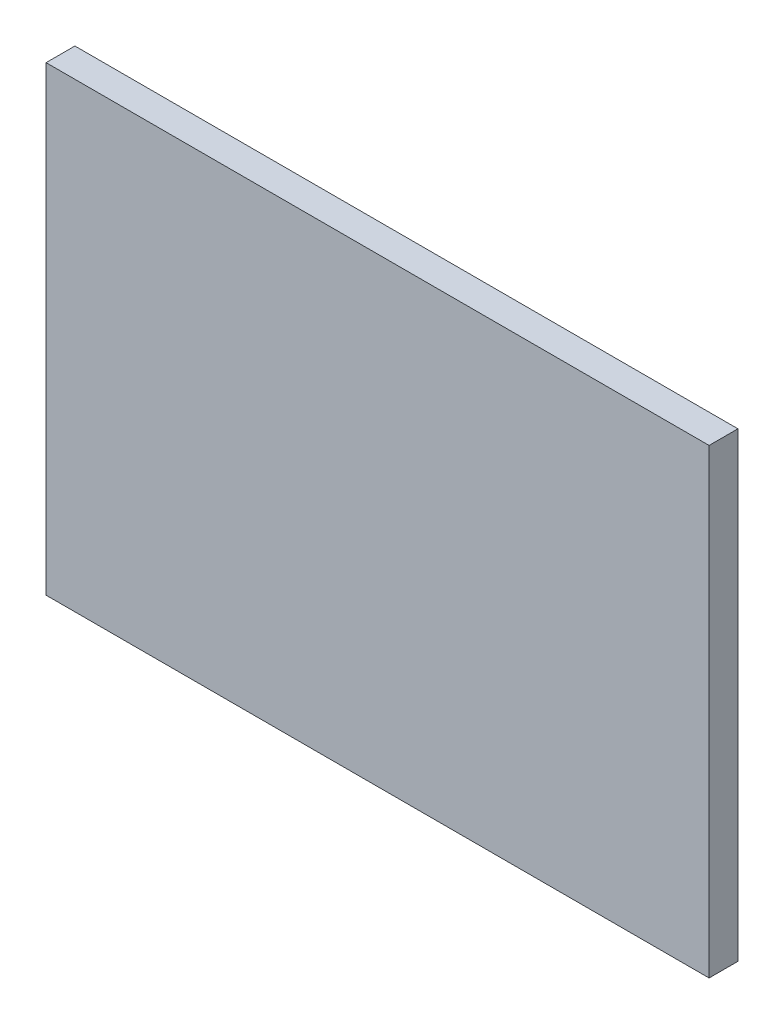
SolidWorks part; units mm, degrees
ref_plane "FRONT" through (0, 0, 0) normal (0, 0, 1) x (1, 0, 0)
ref_plane "TOP" through (0, 0, 0) normal (0, 1, 0) x (1, 0, 0)
ref_plane "RIGHT" through (0, 0, 0) normal (1, 0, 0) x (0, 0, -1)
sketch "Sketch1" plane through (0, 0, 0) normal (0, 0, 1) x (1, 0, 0)
  line L1 (-73.025, -50.8) -> (73.025, -50.8)
  line L2 (-73.025, -50.8) -> (-73.025, 50.8)
  line L3 (-73.025, 50.8) -> (73.025, 50.8)
  line L4 (73.025, -50.8) -> (73.025, 50.8)
  line L5 (-73.025, -50.8) -> (73.025, 50.8) construction
  line L6 (-73.025, 50.8) -> (73.025, -50.8) construction
  point P0 (0, 0)
  dimension "D1" = 146.05
  dimension "D2" = 101.6
extrude "Boss-Extrude1" add sketch "Sketch1" along normal blind 6.35
